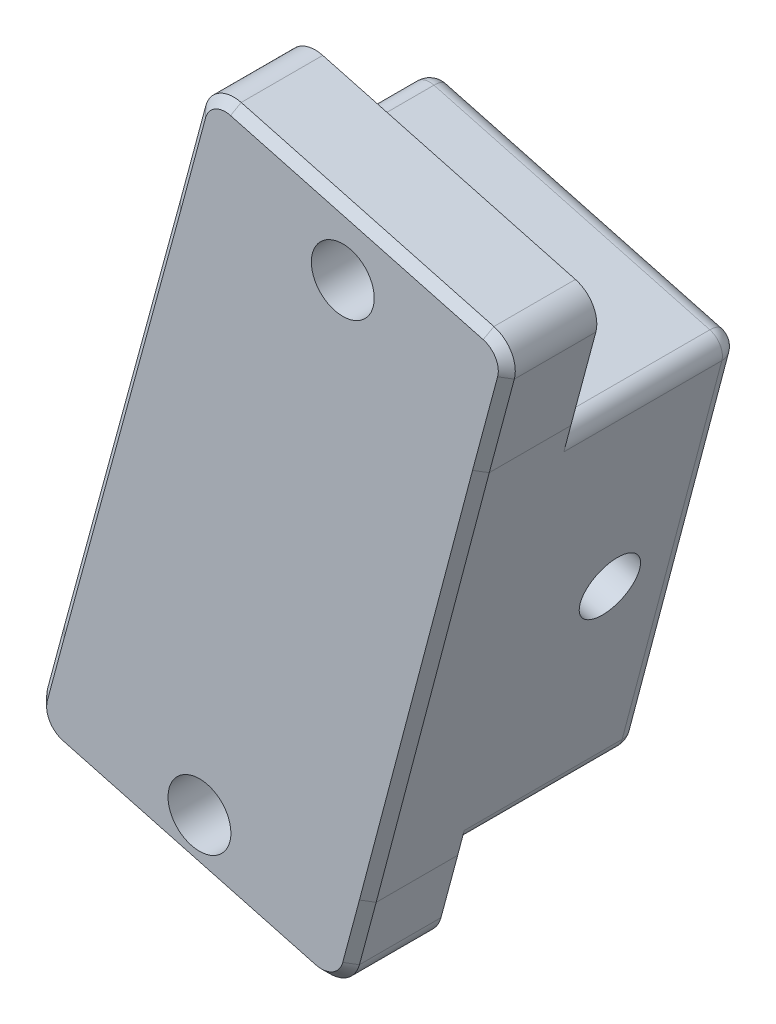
SolidWorks part; units mm, degrees
ref_plane "Front Plane" through (0, 0, 0) normal (0, 0, 1) x (1, 0, 0)
ref_plane "Top Plane" through (0, 0, 0) normal (0, 1, 0) x (1, 0, 0)
ref_plane "Right Plane" through (0, 0, 0) normal (1, 0, 0) x (0, 0, -1)
sketch "Sketch1" plane through (0, 0, 0) normal (0, 0, 1) x (1, 0, 0)
  line L8 (63.3919, -37.7223) -> (55.9543, -35.7294)
  line L9 (54.9132, -36.3304) -> (54.1756, -39.0833)
  line L10 (54.1756, -39.0833) -> (63.2553, -41.5162)
  line L11 (63.2553, -41.5162) -> (63.9929, -38.7633)
  line L12 (63.3919, -37.7223) -> (55.9543, -35.7294)
  line L13 (54.9132, -36.3304) -> (54.1756, -39.0833)
  line L14 (54.1756, -39.0833) -> (63.2553, -41.5162) construction
  line L15 (63.2553, -41.5162) -> (63.9929, -38.7633)
  line L16 (50.7497, -51.6757) -> (54.1756, -39.0833)
  line L17 (63.2553, -41.5162) -> (59.926, -54.1345)
  line L20 (50.7497, -51.6757) -> (50.258, -53.511)
  line L21 (50.8944, -54.6132) -> (58.332, -56.6061)
  line L22 (59.4342, -55.9697) -> (59.926, -54.1345)
  line L23 (59.926, -54.1345) -> (50.7497, -51.6757)
  line L24 (50.7497, -51.6757) -> (50.258, -53.511)
  line L25 (50.8944, -54.6132) -> (58.332, -56.6061)
  line L26 (59.4342, -55.9697) -> (59.926, -54.1345)
  line L27 (59.926, -54.1345) -> (50.7497, -51.6757) construction
  arc A4 (55.9543, -35.7294) -> (54.9132, -36.3304) centre (55.7343, -36.5504) ccw
  arc A5 (63.9929, -38.7633) -> (63.3919, -37.7223) centre (63.1719, -38.5433) ccw
  arc A6 (55.9543, -35.7294) -> (54.9132, -36.3304) centre (55.7343, -36.5504) ccw
  arc A7 (63.9929, -38.7633) -> (63.3919, -37.7223) centre (63.1719, -38.5433) ccw
  circle A8 centre (54.9755, -54.2574) radius 0.925 construction
  circle A9 centre (59.1943, -38.5128) radius 0.925 construction
  arc A10 (50.258, -53.511) -> (50.8944, -54.6132) centre (51.1273, -53.7439) ccw
  arc A11 (58.332, -56.6061) -> (59.4342, -55.9697) centre (58.5649, -55.7368) ccw
  arc A12 (50.258, -53.511) -> (50.8944, -54.6132) centre (51.1273, -53.7439) ccw
  arc A13 (58.332, -56.6061) -> (59.4342, -55.9697) centre (58.5649, -55.7368) ccw
  circle A14 centre (54.9755, -54.2574) radius 0.925
  circle A15 centre (59.1943, -38.5128) radius 0.925
  dimension "D1" = 0.15
  dimension "D2" = 0.1
extrude "Boss-Extrude1" add sketch "Sketch1" along normal up to surface (2.65 mm away)
sketch "Sketch2" plane through (0, 0, 0) normal (0, 0, -1) x (-1, 0, 0)
  line L1 (-59.9898, -53.8928) -> (-50.8153, -51.4345)
  line L2 (-46.8541, -50.3731) -> (-50.7178, -51.4083)
  line L3 (-46.8541, -50.3731) -> (-50.7178, -51.4083) construction
  line L5 (-50.0894, -38.299) -> (-53.9531, -39.3343)
  line L6 (-50.0894, -38.299) -> (-53.9531, -39.3343) construction
  line L8 (-63.1788, -41.8063) -> (-54.0968, -39.3728)
  line L9 (-59.926, -54.1345) -> (-63.2553, -41.5162) construction
  line L10 (-54.1756, -39.0833) -> (-50.7497, -51.6757) construction
  line L11 (-54.0968, -39.3728) -> (-50.8153, -51.4345)
  line L13 (-59.9898, -53.8928) -> (-63.1788, -41.8063)
  dimension "D1" = 0.15
  dimension "D2" = 0.15
extrude "Boss-Extrude2" add sketch "Sketch2" along normal blind 5.15
chamfer "Chamfer2" distance 0.25 angle 45 10 edges at (63.6241, -40.1398, 2.65) (54.5444, -37.7069, 2.65) (63.908, -38.1183, 2.65) (55.3093, -35.8143, 2.65) (59.6731, -36.7258, 2.65) (50.5038, -52.5933, 2.65) (59.6801, -55.0521, 2.65) (50.3479, -54.1939, 2.65) (59.0149, -56.5162, 2.65) (54.6132, -55.6097, 2.65)
fillet "Fillet1" radius 0.5 8 edges at (58.6378, -40.5895, -5.15) (52.4561, -45.4036, -5.15) (55.4026, -52.6636, -5.15) (61.5843, -47.8495, -5.15) (54.0968, -39.3728, -2.575) (63.1788, -41.8063, -2.575) (59.9898, -53.8928, -2.575) (50.8153, -51.4345, -2.575)
sketch "Sketch3" plane through (69.3794, -18.3055, 0) normal (0.9669, -0.2551, 0) x (0, 0, -1)
  circle A0 centre (2.825, -30.5678) radius 0.875
  ellipse E1 centre (30.525, -30.5563) end of major axis (29.65, -30.5563) minor radius 0.875 construction
  ellipse E2 centre (30.525, -30.5563) end of major axis (29.65, -30.5563) minor radius 0.875 construction
  ellipse E3 centre (2.825, -30.5678) end of major axis (3.7436, -30.5678) minor radius 0.9186 (2.0242, -31.0178) -> (2.0242, -30.1178) ccw construction
  ellipse E4 centre (2.825, -30.5678) end of major axis (3.7436, -30.5678) minor radius 0.9186 (2.0242, -31.0178) -> (2.0242, -30.1178) ccw construction
  dimension "D1" = 1.75
extrude "Cut-Extrude1" cut sketch "Sketch3" against normal blind 10
